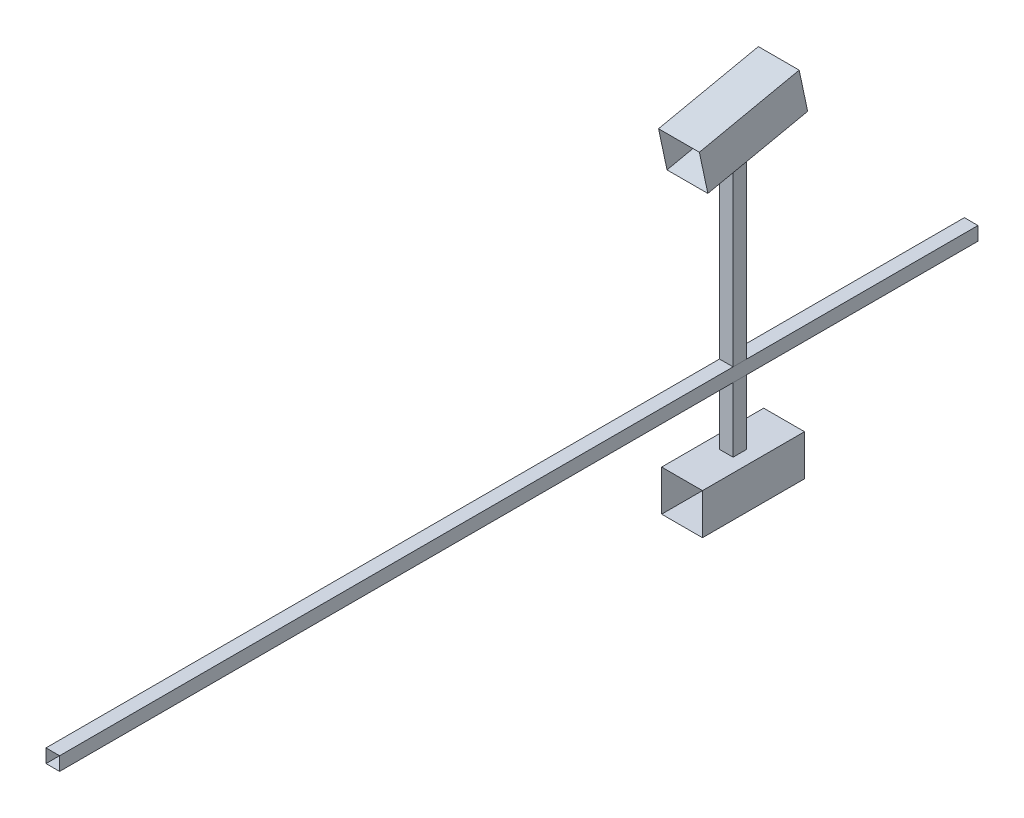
SolidWorks part; units mm, degrees
ref_plane "Plan de face" through (0, 0, 0) normal (0, 0, 1) x (1, 0, 0)
ref_plane "Plan de dessus" through (0, 0, 0) normal (0, 1, 0) x (1, 0, 0)
ref_plane "Plan de droite" through (0, 0, 0) normal (1, 0, 0) x (0, 0, -1)
sketch "Esquisse1" plane through (0, 0, 0) normal (0, 0, 1) x (1, 0, 0)
  line L0 (-6, 6) -> (6, -6) construction
  line L1 (-6, 6) -> (6, 6)
  line L2 (-6, 6) -> (-6, -6)
  line L3 (-6, -6) -> (6, -6)
  line L4 (6, 6) -> (6, -6)
  dimension "D1" = 45
  dimension "D2" = 12
surface "Surface-Extrusion1" sketch "Esquisse1" parameters "D1"=30
sketch "Esquisse2" plane through (0, 0, 0) normal (1, 0, 0) x (0, 0, -1)
  line L0 (-46.3731, 80) -> (0, 89.8569) construction
  line L1 (-46.3731, 80) -> (12.3501, 80) construction
  dimension "D1" = 12
  dimension "D2" = 80
ref_plane "Plan1" through (0, 85.9726, 18.274) normal (0, -0.9781, -0.2079) x (1, 0, 0)
ref_plane "Plan2" through (0, 89.8569, 0) normal (0, 0.2079, -0.9781) x (-1, 0, 0)
sketch "Esquisse3" plane through (0, 89.8569, 0) normal (0, 0.2079, -0.9781) x (-1, 0, 0)
  line L0 (6, 6) -> (-6, -6) construction
  line L1 (6, 6) -> (-6, 6)
  line L2 (6, 6) -> (6, -6)
  line L3 (6, -6) -> (-6, -6)
  line L4 (-6, 6) -> (-6, -6)
  dimension "D1" = 12
  dimension "D2" = 45
surface "Surface-Extrusion2" sketch "Esquisse3" parameters "D1"=30
ref_plane "Plan3" through (0, 10, 0) normal (0, 1, 0) x (-1, 0, 0)
sketch "Esquisse4" plane through (0, 10, 0) normal (0, 1, 0) x (-1, 0, 0)
  line L0 (2, -2) -> (-2, 2) construction
  line L1 (2, -2) -> (-2, -2)
  line L2 (2, -2) -> (2, 2)
  line L3 (2, 2) -> (-2, 2)
  line L4 (-2, -2) -> (-2, 2)
  dimension "D1" = 45
  dimension "D2" = 4
surface "Surface-Extrusion3" sketch "Esquisse4"
sketch "Esquisse5" plane through (0, 0, 0) normal (0, 0, 1) x (1, 0, 0)
  line L1 (-2, 29) -> (2, 29)
  line L2 (-2, 29) -> (-2, 25)
  line L3 (-2, 25) -> (2, 25)
  line L4 (2, 29) -> (2, 25)
  dimension "D1" = 4
  dimension "D2" = 4
  dimension "D3" = 2
  dimension "D4" = 25
surface "Surface-Extrusion4" sketch "Esquisse5" parameters "D1"=200, "D2"=70
